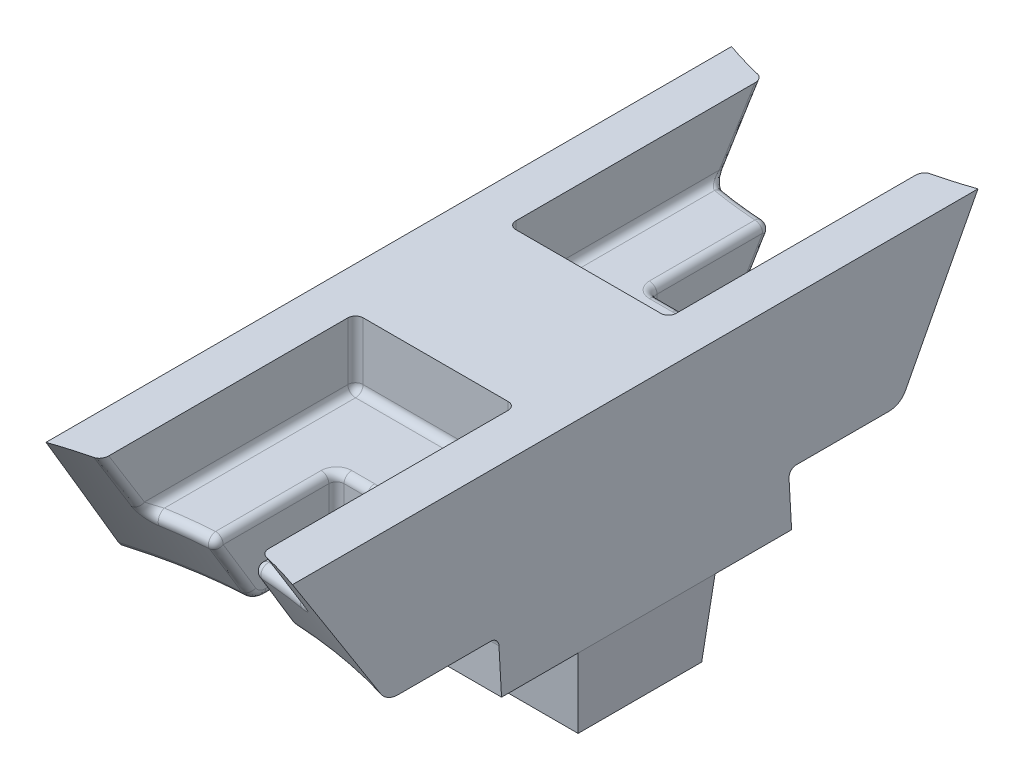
SolidWorks part; units mm, degrees
ref_plane "Plan de face" through (0, 0, 0) normal (0, 0, 1) x (1, 0, 0)
ref_plane "Plan de dessus" through (0, 0, 0) normal (0, 1, 0) x (1, 0, 0)
ref_plane "Plan de droite" through (0, 0, 0) normal (1, 0, 0) x (0, 0, -1)
sketch "Esquisse1" plane through (0, 0, 0) normal (0, 0, 1) x (1, 0, 0)
  line L0 (41.8837, 11.1814) -> (-41.8837, 11.1814) construction
  line L1 (35.2609, 11.1814) -> (-35.2609, 11.1814)
  line L2 (35.2609, 11.1814) -> (32.2885, 61.144)
  line L3 (32.2885, 61.144) -> (-32.2885, 61.144)
  line L4 (-35.2609, 11.1814) -> (-32.2885, 61.144)
  line L5 (0, -21.4211) -> (0, 97.4444) construction
extrude "Boss.-Extru.1" add sketch "Esquisse1" along normal mid plane 200
other "Empreinte1"
other "Couvercle bogie TGV2<2>@Moule 4 pièces1"
other "Couvercle bogie TGV2<1>@Moule 4 pièces1"
sketch "Esquisse2" plane through (0, 11.1814, 0) normal (0, -1, 0) x (1, 0, 0)
  line L0 (-35.2609, 38) -> (-35.2609, -38) construction
  line L1 (35.2609, -17.9423) -> (-35.2609, -17.9423)
  line L2 (35.2609, -17.9423) -> (35.2609, 17.9423)
  line L3 (35.2609, 17.9423) -> (-35.2609, 17.9423)
  line L4 (-35.2609, -17.9423) -> (-35.2609, 17.9423)
  line L5 (35.2609, -17.9423) -> (-35.2609, 17.9423) construction
  line L6 (35.2609, 17.9423) -> (-35.2609, -17.9423) construction
  point P0 (0, 0)
extrude "Boss.-Extru.2" add sketch "Esquisse2" along normal blind 20 draft 5
